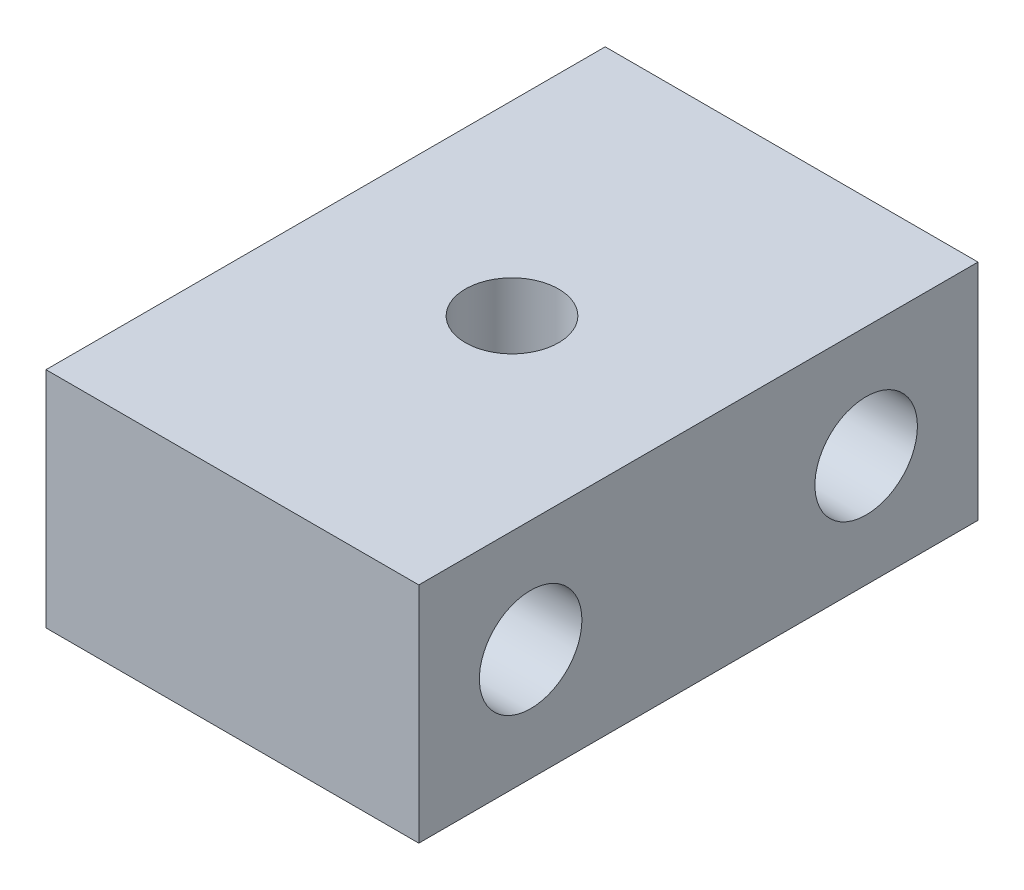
SolidWorks part; units mm, degrees
ref_plane "前视基准面" through (0, 0, 0) normal (0, 0, 1) x (1, 0, 0)
ref_plane "上视基准面" through (0, 0, 0) normal (0, 1, 0) x (1, 0, 0)
ref_plane "右视基准面" through (0, 0, 0) normal (1, 0, 0) x (0, 0, -1)
sketch "草图1" plane through (0, 0, 0) normal (0, 0, 1) x (1, 0, 0)
  line L0 (0, 12) -> (20, 12)
  line L1 (0, 0) -> (20, 0)
  line L2 (20, 0) -> (20, 12)
  line L3 (0, 0) -> (0, 12)
extrude "凸台-拉伸1" add sketch "草图1" along normal blind 30
sketch "草图2" plane through (20, 0, 0) normal (1, 0, 0) x (0, 0, -1)
  circle A0 centre (-24, 6) radius 2.75
  circle A1 centre (-6, 6) radius 2.75
extrude "切除-拉伸1" cut sketch "草图2" against normal blind 30
sketch "草图3" plane through (0, 0, 0) normal (-1, 0, 0) x (0, 0, 1)
  circle A0 centre (6, 6) radius 4.75
  circle A1 centre (24, 6) radius 4.75
extrude "切除-拉伸2" cut sketch "草图3" against normal blind 5.5
sketch "草图4" plane through (0, 12, 0) normal (0, 1, 0) x (1, 0, 0)
  circle A0 centre (10, -15) radius 2.5
extrude "切除-拉伸3" cut sketch "草图4" against normal through all
